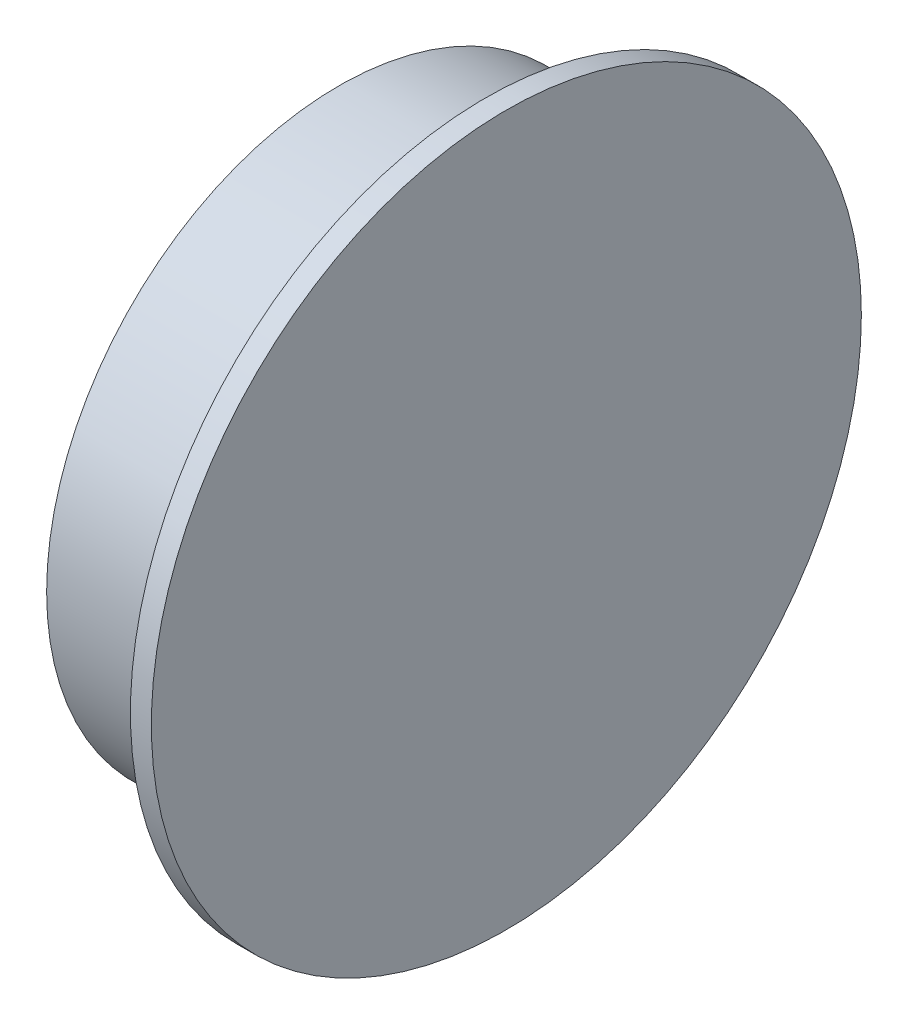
SolidWorks part; units mm, degrees
ref_plane "Front Plane" through (0, 0, 0) normal (0, 0, 1) x (1, 0, 0)
ref_plane "Top Plane" through (0, 0, 0) normal (0, 1, 0) x (1, 0, 0)
ref_plane "Right Plane" through (0, 0, 0) normal (1, 0, 0) x (0, 0, -1)
sketch "Esquisse1" plane through (0, 0, 0) normal (0, 0, 1) x (1, 0, 0)
  line L0 (-5.5, 13.95) -> (1.5, 13.95)
  line L1 (0, 12.75) -> (0, 0)
  line L2 (-5.5, 12.75) -> (0, 12.75)
  line L3 (1.5, 0) -> (1.5, 13.95)
  line L5 (-5.5, 12.75) -> (-5.5, 13.95)
  line L6 (-7.2154, 0) -> (12.7386, 0) construction
  line L8 (0, 0) -> (1.5, 0)
  dimension "D1" = 12.75
  dimension "D2" = 1.2
  dimension "D3" = 7
  dimension "D4" = 1.5
revolve "Révolution1" add sketch "Esquisse1" angle 360 about L6
chamfer "Chanfrein1" distance 0.5 angle 45 1 edges at (-5.5, 0, 12.75)
sketch "Esquisse2" plane through (1.5, 0, 0) normal (1, 0, 0) x (0, 0, -1)
  circle A0 centre (0, 0) radius 16.95
  circle A2 centre (0, 0) radius 13.95 construction
  dimension "D1" = 3
extrude "Boss.-Extru.1" add sketch "Esquisse2" along normal blind 1
fillet "Congé1" radius 1.2 1 edges at (1.5, 0, -13.95)
